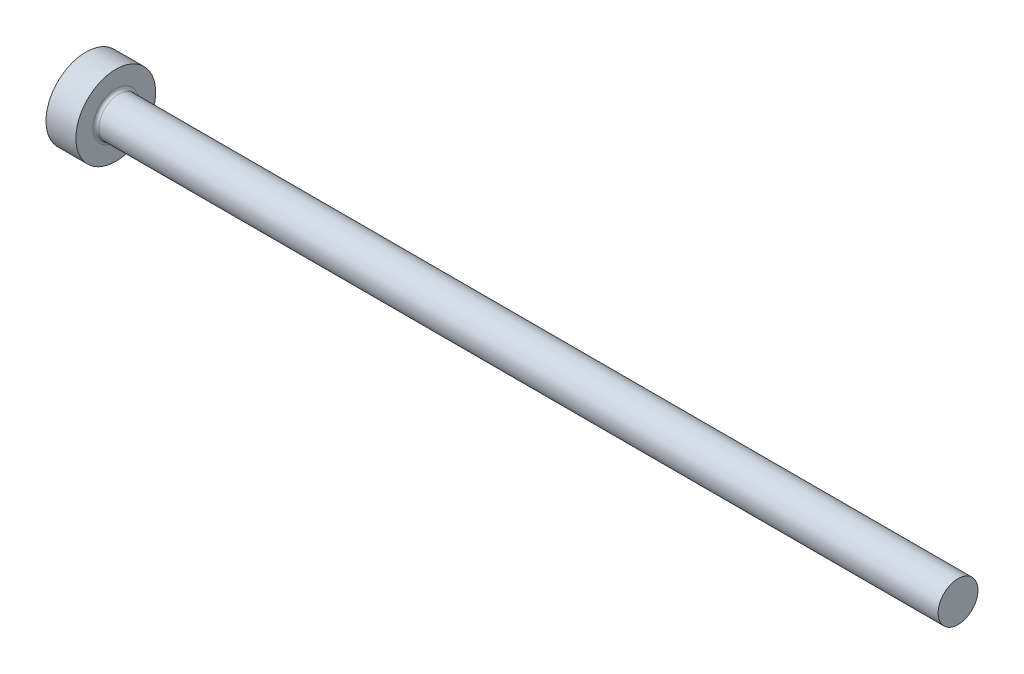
SolidWorks part; units mm, degrees
ref_plane "Face" through (0, 0, 0) normal (0, 0, 1) x (1, 0, 0)
ref_plane "Dessus" through (0, 0, 0) normal (0, 1, 0) x (1, 0, 0)
ref_plane "Droite" through (0, 0, 0) normal (1, 0, 0) x (0, 0, -1)
imported_body "Importée1"
ref_plane "Plan1" through (87.47, 0, 0) normal (1, 0, 0) x (0, 0, -1)
sketch "Esquisse1" plane through (87.47, 0, 0) normal (1, 0, 0) x (0, 0, -1)
  circle A0 centre (0, 0) radius 2 construction
  circle A1 centre (0, 0) radius 2
extrude "Enlèv. mat.-Extru.2" cut sketch "Esquisse1" along normal through all
